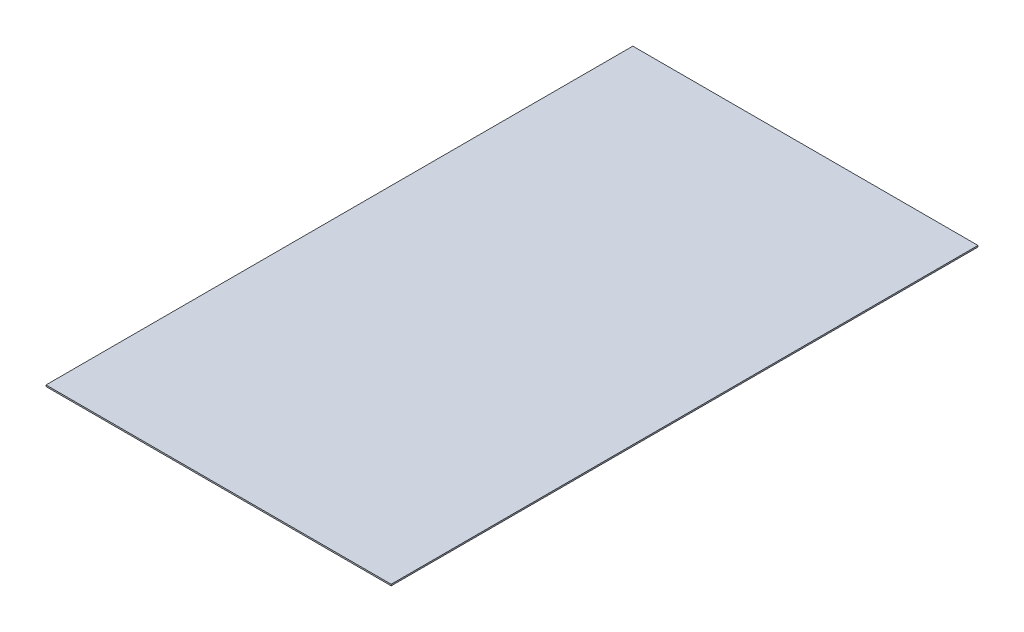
SolidWorks part; units mm, degrees
ref_plane "FRONT" through (0, 0, 0) normal (0, 0, 1) x (1, 0, 0)
ref_plane "TOP" through (0, 0, 0) normal (0, 1, 0) x (1, 0, 0)
ref_plane "RIGHT" through (0, 0, 0) normal (1, 0, 0) x (0, 0, -1)
sketch "Sketch1" plane through (0, 0, 0) normal (0, 1, 0) x (1, 0, 0)
  line L1 (0, 0) -> (1524, 0)
  line L2 (0, 0) -> (0, -2590.8)
  line L3 (0, -2590.8) -> (1524, -2590.8)
  line L4 (1524, 0) -> (1524, -2590.8)
  dimension "D1" = 2590.8
  dimension "D2" = 1524
extrude "Boss-Extrude1" add sketch "Sketch1" along normal blind 6.35
